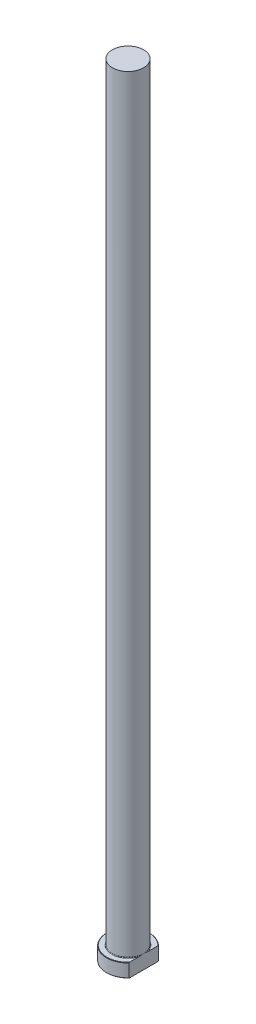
SolidWorks part; units mm, degrees
ref_plane "Front Plane" through (0, 0, 0) normal (0, 0, 1) x (1, 0, 0)
ref_plane "Top Plane" through (0, 0, 0) normal (0, 1, 0) x (1, 0, 0)
ref_plane "Right Plane" through (0, 0, 0) normal (1, 0, 0) x (0, 0, -1)
sketch "Sketch1" plane through (0, 0, 0) normal (0, 0, 1) x (1, 0, 0)
  line L0 (0, 259.9588) -> (0, -15.1925) construction
  line L1 (0, 0) -> (-11, 0)
  line L2 (-11, 0) -> (-11, 7)
  line L3 (-11, 7) -> (-8, 7)
  line L4 (-8, 7) -> (-8, 400)
  line L5 (-8, 400) -> (0, 400)
  line L6 (0, 400) -> (0, 0)
  dimension "L" = 400
  dimension "H" = 22
  dimension "T" = 7
  dimension "D" = 16
revolve "Revolve1" add sketch "Sketch1" angle 360 about L0
chamfer "Chamfer1" distance 0.2 angle 45 2 edges at (0, 7, 11) (0, 0, 11)
fillet "Fillet1" radius 0.3 1 edges at (0, 7, 8)
sketch "Sketch2" plane through (0, 0, 0) normal (0, 1, 0) x (1, 0, 0)
  line L0 (8, 7.5498) -> (8, -7.5498)
  circle A0 centre (0, 0) radius 11 construction
  arc A1 (8, -7.5498) -> (8, 7.5498) centre (0, 0) ccw
  circle A2 centre (0, 0) radius 8 construction
extrude "KEY" cut sketch "Sketch2" along normal through all
